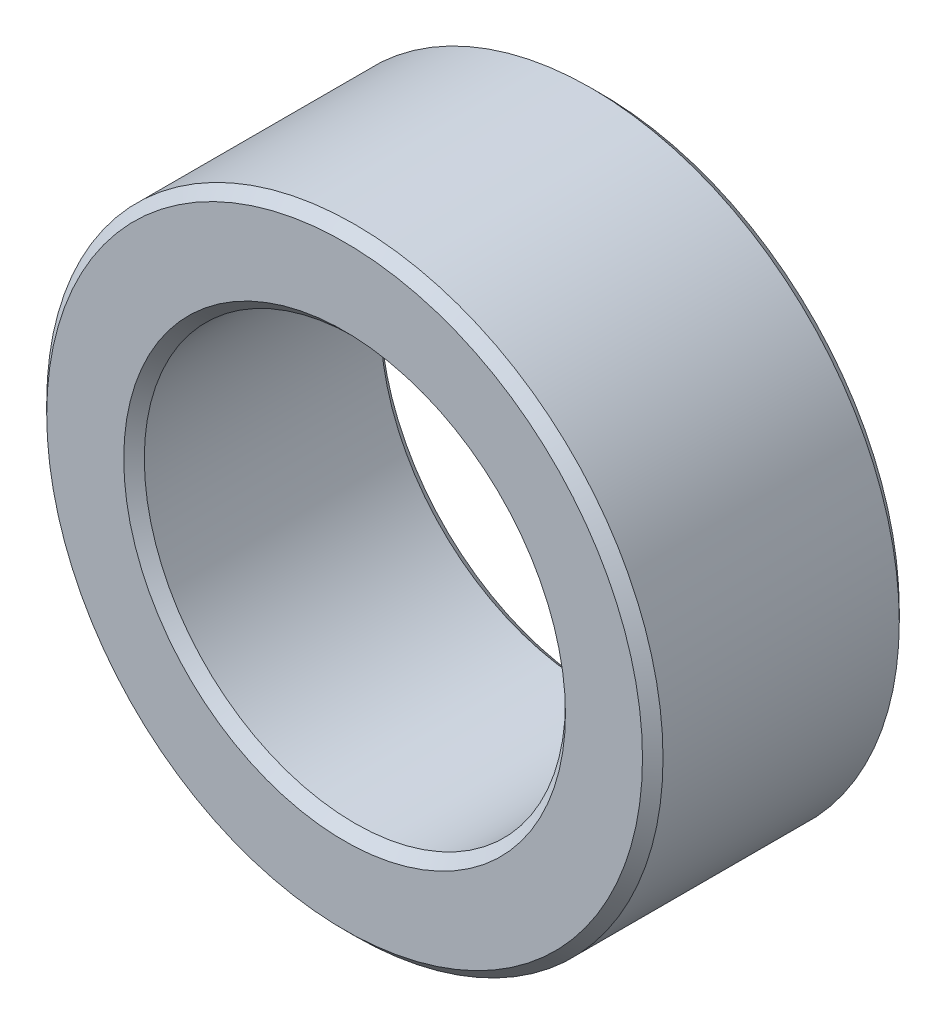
SolidWorks part; units mm, degrees
ref_plane "Front Plane" through (0, 0, 0) normal (0, 0, 1) x (1, 0, 0)
ref_plane "Top Plane" through (0, 0, 0) normal (0, 1, 0) x (1, 0, 0)
ref_plane "Right Plane" through (0, 0, 0) normal (1, 0, 0) x (0, 0, -1)
sketch "Sketch1" plane through (0, 0, 0) normal (0, 0, 1) x (1, 0, 0)
  circle A0 centre (0, 0) radius 6
  circle A1 centre (0, 0) radius 4.1
  dimension "D1" = 12
  dimension "D2" = 8.2
extrude "Boss-Extrude2" add sketch "Sketch1" along normal mid plane 5
chamfer "Chamfer3" distance 0.2 angle 45 4 edges at (6, 0, 2.5) (6, 0, -2.5) (4.1, 0, -2.5) (4.1, 0, 2.5)
